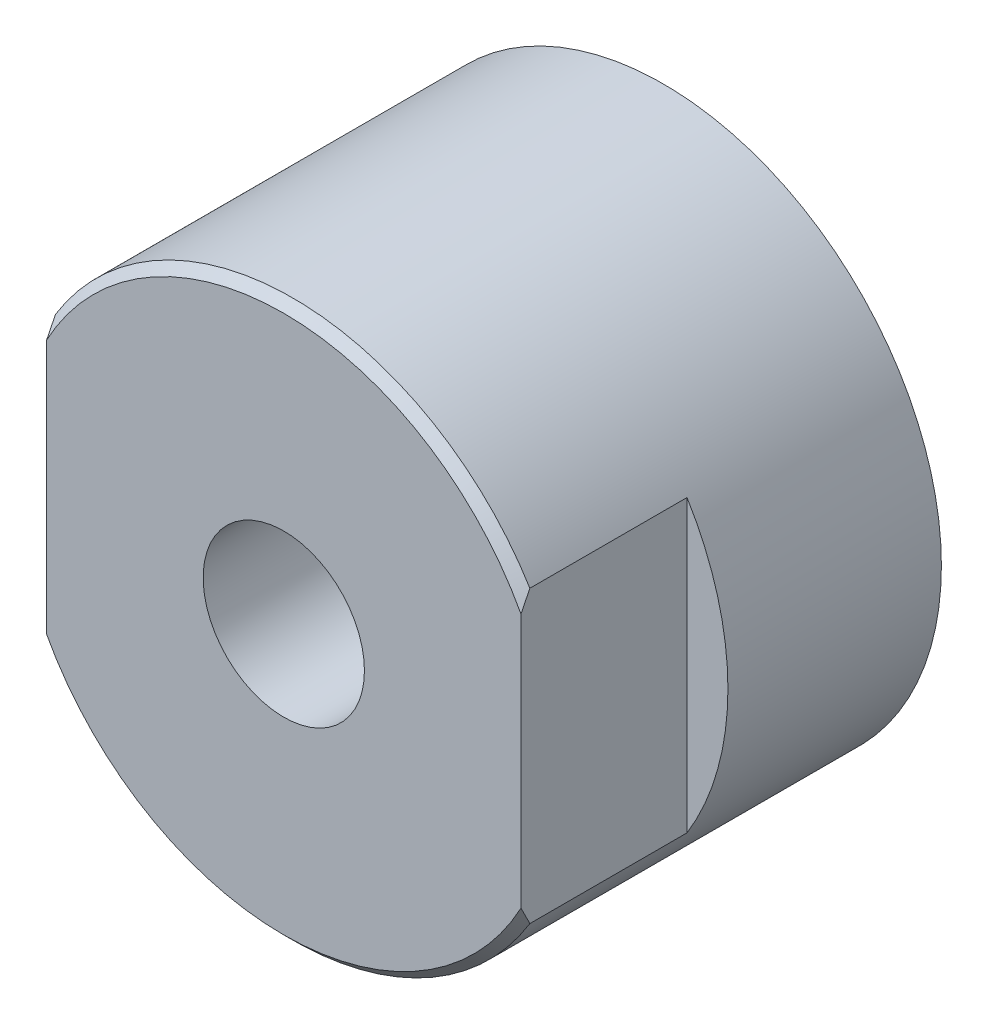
SolidWorks part; units mm, degrees
ref_plane "Front" through (0, 0, 0) normal (0, 0, 1) x (1, 0, 0)
ref_plane "Top" through (0, 0, 0) normal (0, 1, 0) x (1, 0, 0)
ref_plane "Right" through (0, 0, 0) normal (1, 0, 0) x (0, 0, -1)
sketch "Sketch1" plane through (0, 0, 0) normal (0, 0, 1) x (1, 0, 0)
  circle A0 centre (0, 0) radius 11.9126
  dimension "D1" = 23.8252
extrude "Base-Extrude" add sketch "Sketch1" along normal blind 16.256
sketch "Sketch2" plane through (0, 0, 16.256) normal (0, 0, 1) x (1, 0, 0)
  circle A0 centre (0, 0) radius 3.4544
  dimension "D1" = 6.9088
extrude "Cut-Extrude1" cut sketch "Sketch2" against normal through all
sketch "Sketch3" plane through (0, 0, 0) normal (0, 0, -1) x (-1, 0, 0)
  circle A0 centre (0, 0) radius 4.2164
  dimension "D1" = 8.4328
extrude "Cut-Extrude2" cut sketch "Sketch3" against normal blind 9.906
sketch "Sketch4" plane through (0, 0, 0) normal (0, 0, -1) x (-1, 0, 0)
  circle A0 centre (0, 0) radius 6.2484
  circle A1 centre (0, 0) radius 8.3312
  dimension "D1" = 12.4968
  dimension "D2" = 2.0828
extrude "Cut-Extrude3" cut sketch "Sketch4" against normal blind 1.397
sketch "Sketch5" plane through (0, 0, 16.256) normal (0, 0, 1) x (1, 0, 0)
  line L0 (0, 12.9139) -> (0, -13.2823) construction
  line L1 (10.16, 12.9139) -> (10.16, -13.2823)
  line L2 (-10.16, 12.9139) -> (-10.16, -13.2823)
  line L3 (10.16, 12.9139) -> (21.6712, 12.9139)
  line L4 (21.6712, 12.9139) -> (21.6712, -13.2823)
  line L5 (21.6712, -13.2823) -> (10.16, -13.2823)
  line L6 (-10.16, 12.9139) -> (-22.9275, 12.9139)
  line L7 (-22.9275, 12.9139) -> (-22.9275, -13.2823)
  line L8 (-22.9275, -13.2823) -> (-10.16, -13.2823)
  dimension "D1" = 10.16
  dimension "D2" = 10.16
extrude "Cut-Extrude4" cut sketch "Sketch5" against normal blind 7.112
chamfer "Chamfer1" distance 0.381 angle 45
fillet "Fillet1" radius 0.381
fillet "Fillet2" radius 0.127
